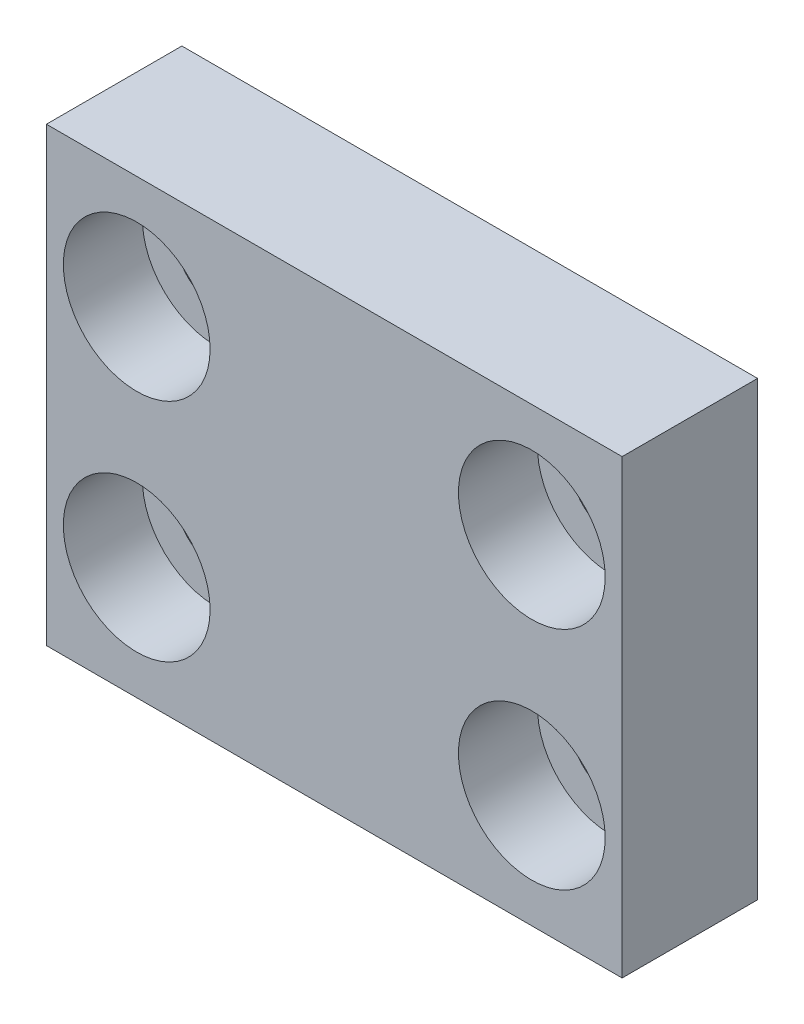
SolidWorks part; units mm, degrees
ref_plane "前视基准面" through (0, 0, 0) normal (0, 0, 1) x (1, 0, 0)
ref_plane "上视基准面" through (0, 0, 0) normal (0, 1, 0) x (1, 0, 0)
ref_plane "右视基准面" through (0, 0, 0) normal (1, 0, 0) x (0, 0, -1)
sketch "草图1" plane through (0, 0, 0) normal (0, 0, 1) x (1, 0, 0)
  line L0 (0, -20) -> (25.5, -20)
  line L1 (0, 0) -> (25.5, 0)
  line L2 (0, -20) -> (0, 0)
  line L3 (25.5, -20) -> (25.5, 0)
  circle A0 centre (4, -15) radius 1.75
  circle A1 centre (21.5, -15) radius 1.75
  circle A2 centre (21.5, -5) radius 1.75
  circle A3 centre (4, -5) radius 1.75
extrude "凸台-拉伸1" add sketch "草图1" along normal blind 6
sketch "草图2" plane through (0, 0, 6) normal (0, 0, 1) x (1, 0, 0)
  circle A0 centre (4, -15) radius 3.25
  circle A1 centre (21.5, -15) radius 3.25
  circle A2 centre (21.5, -5) radius 3.25
  circle A3 centre (4, -5) radius 3.25
extrude "切除-拉伸1" cut sketch "草图2" against normal blind 3.5
